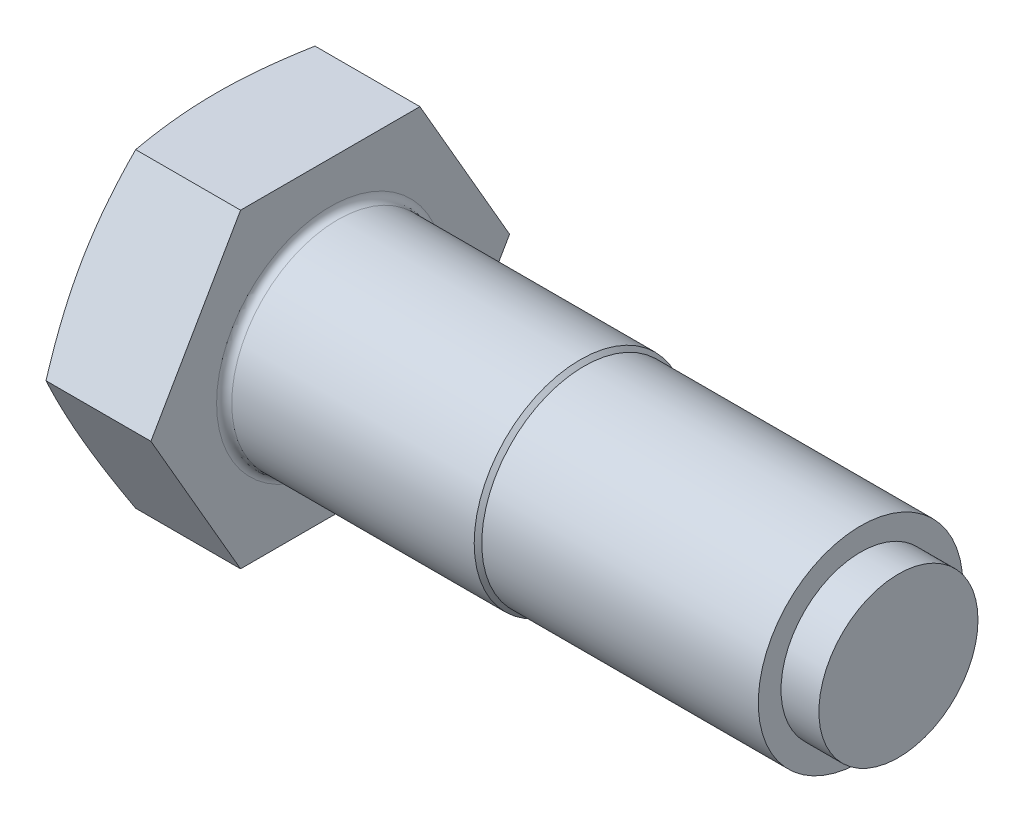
SolidWorks part; units mm, degrees
ref_plane "Front" through (0, 0, 0) normal (0, 0, 1) x (1, 0, 0)
ref_plane "Top" through (0, 0, 0) normal (0, 1, 0) x (1, 0, 0)
ref_plane "Right" through (0, 0, 0) normal (1, 0, 0) x (0, 0, -1)
sketch "Sketch1" plane through (0, 0, 0) normal (1, 0, 0) x (0, 0, -1)
  line L1 (23.6714, 0) -> (11.8357, 20.5)
  line L2 (11.8357, 20.5) -> (-11.8357, 20.5)
  line L3 (-11.8357, 20.5) -> (-23.6714, 0)
  line L4 (-23.6714, 0) -> (-11.8357, -20.5)
  line L5 (-11.8357, -20.5) -> (11.8357, -20.5)
  line L6 (11.8357, -20.5) -> (23.6714, 0)
  circle A0 centre (0, 0) radius 20.5 construction
  dimension "s" = 41
extrude "BaseHead" add sketch "Sketch1" along normal blind 15
sketch "Sketch2" plane through (15, 0, 0) normal (1, 0, 0) x (0, 0, -1)
  circle A0 centre (0, 0) radius 14
  dimension "ds" = 28
extrude "Basebody1" add sketch "Sketch2" along normal blind 33
sketch "Sketch4" plane through (48, 0, 0) normal (1, 0, 0) x (0, 0, -1)
  circle A0 centre (0, 0) radius 13.5
  dimension "d" = 27
extrude "Basebody2" add sketch "Sketch4" along normal offset from surface (42 mm away) 75
sketch "Sketch5" plane through (90, 0, 0) normal (1, 0, 0) x (0, 0, -1)
  circle A0 centre (0, 0) radius 10.5
  dimension "dp" = 21
extrude "Cut-Extrude1" cut sketch "Sketch5" against normal blind 5 flip side to cut
sketch "Sketch6" plane through (0, 0, 0) normal (0, 1, 0) x (1, 0, 0)
  line L0 (0, 23.6714) -> (1.1543, 23.6714)
  line L1 (1.1543, 23.6714) -> (0, 20.5)
  line L3 (0, 20.5) -> (0, 23.6714)
  line L4 (-1.5773, 0) -> (3.1205, 0) construction
  line L6 (15, 23.6714) -> (0, 23.6714) construction
  dimension "D1" = 20
  dimension "D2" = 41
revolve "HeadChamfer" cut sketch "Sketch6" angle 360 about L4
fillet "HeadFillet" radius 1 1 edges at (15, 0, -14)
chamfer "Chamfer1" distance 0.5 angle 45 1 edges at (48, 0, -13.5)
equation "\"D1@Chamfer1\" =  ( \"ds@Sketch2\" - \"d@Sketch4\" )  / 2"
equation "\"D2@Sketch6\" = \"s@Sketch1\""
